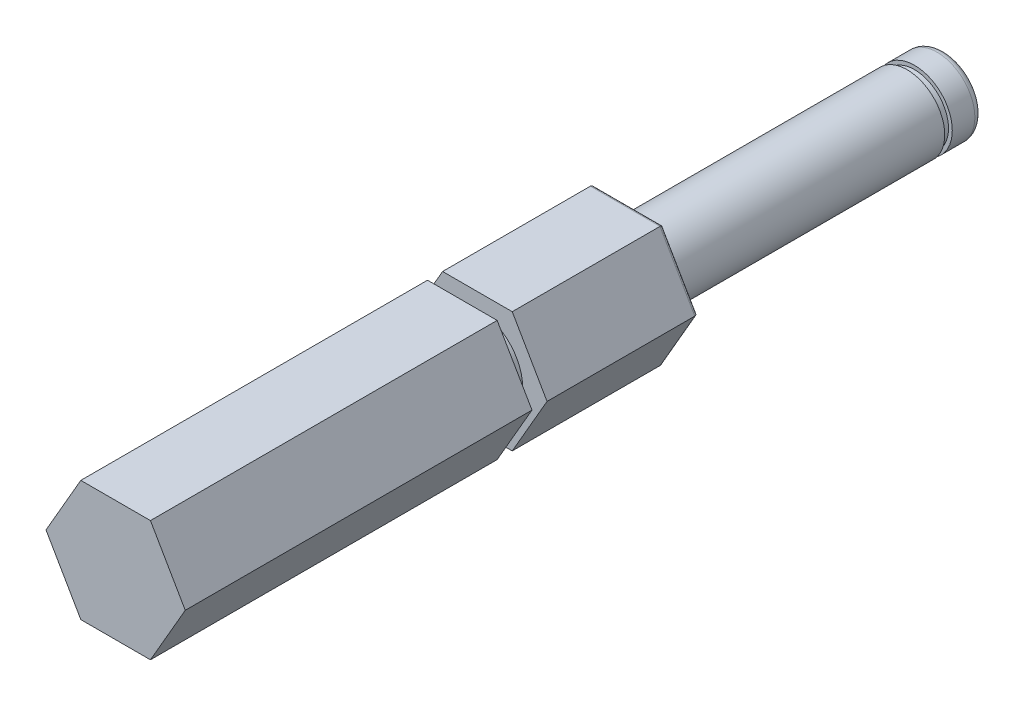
SolidWorks part; units mm, degrees
ref_plane "Plane1" through (0, 0, 0) normal (0, 0, 1) x (1, 0, 0)
ref_plane "Plane2" through (0, 0, 0) normal (0, 1, 0) x (1, 0, 0)
ref_plane "Plane3" through (0, 0, 0) normal (1, 0, 0) x (0, 0, -1)
sketch "Esquisse1" plane through (0, 0, 0) normal (0, 0, 1) x (1, 0, 0)
  line L1 (4.6188, 0) -> (2.3094, 4)
  line L2 (2.3094, 4) -> (-2.3094, 4)
  line L3 (-2.3094, 4) -> (-4.6188, 0)
  line L4 (-4.6188, 0) -> (-2.3094, -4)
  line L5 (-2.3094, -4) -> (2.3094, -4)
  line L6 (2.3094, -4) -> (4.6188, 0)
  circle A0 centre (0, 0) radius 4 construction
  dimension "D1" = 8
extrude "Base-Extrusion" add sketch "Esquisse1" against normal blind 23
sketch "Esquisse2" plane through (0, 0, -23) normal (0, 0, -1) x (-1, 0, 0)
  circle A0 centre (0, 0) radius 3
  dimension "D1" = 6
extrude "Boss.-Extru.1" add sketch "Esquisse2" along normal blind 1
sketch "Esquisse3" plane through (0, 0, -24) normal (0, 0, -1) x (-1, 0, 0)
  line L0 (2.3094, -4) -> (-2.3094, -4) construction
  line L1 (4.6188, 0) -> (2.3094, -4) construction
  line L2 (2.3094, 4) -> (4.6188, 0) construction
  line L3 (-2.3094, 4) -> (2.3094, 4) construction
  line L4 (-4.6188, 0) -> (-2.3094, 4) construction
  line L5 (-2.3094, -4) -> (-4.6188, 0) construction
  line L6 (2.3094, -4) -> (-2.3094, -4)
  line L7 (4.6188, 0) -> (2.3094, -4)
  line L8 (2.3094, 4) -> (4.6188, 0)
  line L9 (-2.3094, 4) -> (2.3094, 4)
  line L10 (-4.6188, 0) -> (-2.3094, 4)
  line L11 (-2.3094, -4) -> (-4.6188, 0)
extrude "Boss.-Extru.2" add sketch "Esquisse3" along normal blind 10
sketch "Esquisse4" plane through (0, 0, -34) normal (0, 0, -1) x (-1, 0, 0)
  circle A0 centre (0, 0) radius 2.5
  dimension "D1" = 5
extrude "Boss.-Extru.3" add sketch "Esquisse4" along normal blind 21
fillet "Congé1" radius 0.2
fillet "Congé2" radius 0.5
sketch "Esquisse16" plane through (0, 0, 0) normal (0, 1, 0) x (1, 0, 0)
  line L0 (0, 39.7867) -> (0, 60) construction
  line L1 (0, 24) -> (0, 23) construction
  line L3 (2.25, 53) -> (2.5, 53)
  line L4 (2.25, 53) -> (2.25, 52.5)
  line L5 (2.25, 52.5) -> (2.5, 52.5)
  line L6 (2.5, 53) -> (2.5, 52.5)
  line L7 (2, 55) -> (-2, 55) construction
  dimension "D1" = 0.25
  dimension "D2" = 0.5
  dimension "D3" = 2
  dimension "D4" = 5
revolve "Enlèvement de matière-Révolution1" cut sketch "Esquisse16" angle 360 about L0
